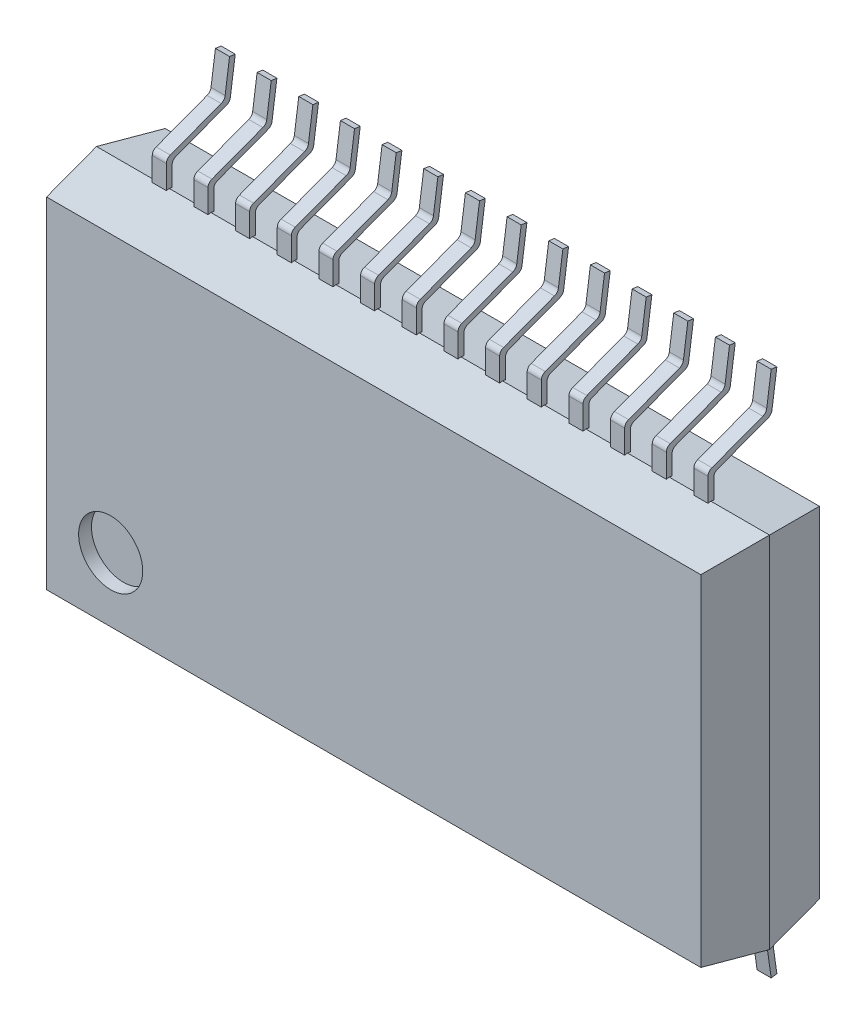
SolidWorks part; units mm, degrees
ref_plane "Plano frontal" through (0, 0, 0) normal (0, 0, 1) x (1, 0, 0)
ref_plane "Plano superior" through (0, 0, 0) normal (0, 1, 0) x (1, 0, 0)
ref_plane "Plano direito" through (0, 0, 0) normal (1, 0, 0) x (0, 0, -1)
sketch "Esboço1" plane through (0, 0, 0) normal (0, 0, 1) x (1, 0, 0)
  line L1 (-0.915, 5.6) -> (9.585, 5.6)
  line L2 (-0.915, 5.6) -> (-0.915, 0)
  line L3 (-0.915, 0) -> (9.585, 0)
  line L4 (9.585, 5.6) -> (9.585, 0)
extrude "Extrusão1" add sketch "Esboço1" along normal blind 0.925 draft 9
sketch "Esboço2" plane through (0, 0, 0) normal (0, 0, 1) x (1, 0, 0)
  line L0 (-0.915, 5.6) -> (9.585, 5.6)
  line L1 (-0.915, 5.6) -> (-0.915, 0)
  line L2 (-0.915, 0) -> (9.585, 0)
  line L3 (9.585, 5.6) -> (9.585, 0)
extrude "Extrusão2" add sketch "Esboço2" against normal blind 0.925 draft 9 separate body
sketch "Esboço3" plane through (0, 0, 0) normal (1, 0, 0) x (0, 0, -1)
  line L2 (1.03, 6.9) -> (0.9409, 6.9125)
  line L4 (-0.045, 5.9583) -> (-0.045, 5.5929)
  line L5 (1.03, 6.9) -> (0.9527, 6.35)
  line L6 (0.0164, 6.0437) -> (0.8104, 6.3425)
  line L7 (0.8719, 6.4214) -> (0.9409, 6.9125)
  line L8 (0.045, 5.896) -> (0.045, 5.5929)
  line L9 (0, 0) -> (0.045, 0.0071)
  line L10 (0.1064, 5.9814) -> (0.8953, 6.2783)
  line L11 (-0.925, 5.4535) -> (0, 5.6) construction
  line L12 (0.925, 5.4535) -> (0, 5.6) construction
  line L13 (-0.045, 5.5929) -> (0, 5.6)
  line L14 (0, 5.6) -> (0.045, 5.5929)
  line L15 (-0.045, 0.0071) -> (0, 0)
  line L16 (0.1064, -0.3814) -> (0.8953, -0.6783)
  line L17 (0.045, -0.296) -> (0.045, 0.0071)
  line L18 (0.8719, -0.8214) -> (0.9409, -1.3125)
  line L19 (0.0164, -0.4437) -> (0.8104, -0.7425)
  line L20 (1.03, -1.3) -> (0.9527, -0.75)
  line L21 (-0.045, -0.3583) -> (-0.045, 0.0071)
  line L22 (1.03, -1.3) -> (0.9409, -1.3125)
  arc A0 (-0.045, 5.9583) -> (0.0164, 6.0437) centre (0.0429, 5.9598) cw
  arc A1 (0.045, 5.896) -> (0.1064, 5.9814) centre (0.1329, 5.8976) cw
  arc A2 (0.8953, 6.2783) -> (0.9527, 6.35) centre (0.8614, 6.3643) ccw
  arc A3 (0.8719, 6.4214) -> (0.8104, 6.3425) centre (0.7796, 6.4299) cw
  arc A4 (0.8719, -0.8214) -> (0.8104, -0.7425) centre (0.7796, -0.8299) ccw
  arc A5 (0.8953, -0.6783) -> (0.9527, -0.75) centre (0.8614, -0.7643) cw
  arc A6 (0.045, -0.296) -> (0.1064, -0.3814) centre (0.1329, -0.2976) ccw
  arc A7 (-0.045, -0.3583) -> (0.0164, -0.4437) centre (0.0429, -0.3598) ccw
extrude "Extrusão3" add sketch "Esboço3" along normal blind 0.22 separate body
pattern_linear "Padrão linear2" count 14 spacing 0.65 along (1, 0, 0)
sketch "Esboço7" plane through (0, 0, 0) normal (0, 0, 1) x (1, 0, 0)
  circle A1 centre (0.2315, 1.1465) radius 0.5
extrude "Corte-extrusão1" cut sketch "Esboço7" along normal blind 0.2 and the other way blind 0.2 from surface at 0.925
